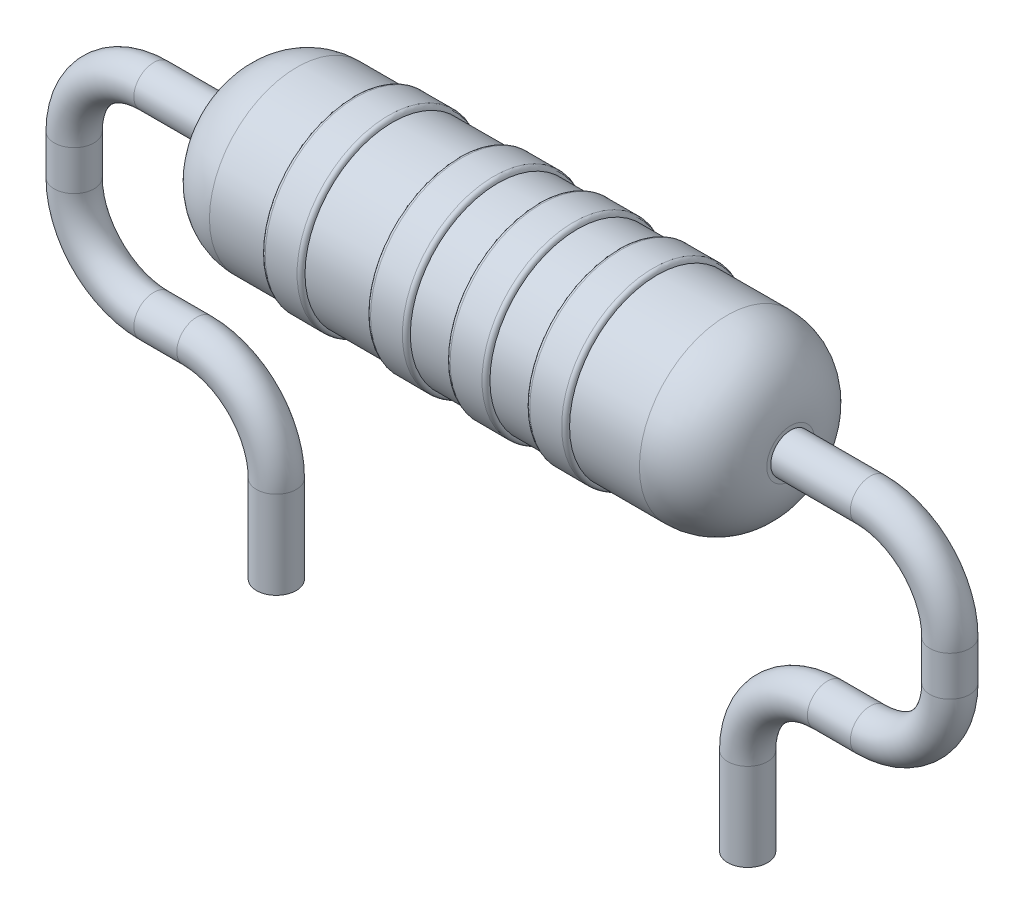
SolidWorks part; units mm, degrees
ref_plane "Face" through (0, 0, 0) normal (0, 0, 1) x (1, 0, 0)
ref_plane "Dessus" through (0, 0, 0) normal (0, 1, 0) x (1, 0, 0)
ref_plane "Droite" through (0, 0, 0) normal (1, 0, 0) x (0, 0, -1)
sketch "Esquisse1" plane through (0, 0, 0) normal (0, 0, 1) x (1, 0, 0)
  line L0 (-54.2687, 0) -> (62.1733, 0) construction
  line L1 (-48.4922, 1.1) -> (45.7559, 1.1) construction
  line L2 (-3.5, -1.6411) -> (-3.5, 4.3175) construction
  line L3 (0, -1.0268) -> (0, 4.1947) construction
  line L4 (3.5, 3.6009) -> (3.5, -1.9687) construction
  line L5 (-3.5, 0) -> (-3.5, 0.3)
  line L6 (-2.7, 1.1) -> (2.7, 1.1)
  line L7 (3.5, 0.3) -> (3.5, 0)
  line L8 (3.5, 0) -> (-3.5, 0)
  arc A0 (-2.7, 1.1) -> (-3.5, 0.3) centre (-2.7, 0.3) ccw
  arc A1 (3.5, 0.3) -> (2.7, 1.1) centre (2.7, 0.3) ccw
revolve "Base-Révolution" add sketch "Esquisse1" angle 360 about L0
sketch "Esquisse2" plane through (0, 0, 0) normal (0, 0, 1) x (1, 0, 0)
  line L0 (-3.3896, 1.15) -> (3.161, 1.15) construction
  line L1 (-2, 1.3889) -> (-2, -0.1179) construction
  line L2 (-1.5, 1.4925) -> (-1.5, -0.2136) construction
  line L3 (4.3262, 0) -> (-3.8651, 0) construction
  line L4 (1.323, 0) -> (1.823, 0)
  line L5 (0.323, 0) -> (0.823, 0)
  line L6 (-0.677, 1.15) -> (-0.677, 0)
  line L7 (0.323, 1.15) -> (0.323, 0)
  line L8 (1.323, 1.15) -> (1.323, 0)
  line L9 (-0.177, 1.15) -> (-0.177, 0)
  line L10 (0.823, 1.15) -> (0.823, 0)
  line L11 (1.823, 1.15) -> (1.823, 0)
  line L12 (-0.677, 0) -> (-0.177, 0)
  line L13 (-0.677, 1.15) -> (-0.177, 1.15)
  line L14 (0.323, 1.15) -> (0.823, 1.15)
  line L15 (1.323, 1.15) -> (1.823, 1.15)
  line L16 (-2, 1.15) -> (-1.5, 1.15)
  line L17 (-1.5, 1.15) -> (-1.5, 0)
  line L18 (-1.5, 0) -> (-2, 0)
  line L19 (-2, 0) -> (-2, 1.15)
revolve "Boss.-Révol.1" add sketch "Esquisse2" angle 360 about L3
fillet "Congé1" radius 0.05 8 edges at (-0.677, 0, -1.15) (-0.177, 0, -1.15) (0.323, 0, -1.15) (0.823, 0, -1.15) (1.323, 0, -1.15) (1.823, 0, -1.15) (-1.5, 0, -1.15) (-2, 0, -1.15)
sketch "Esquisse3" plane through (-3.5, 0, 0) normal (-1, 0, 0) x (0, 0, 1)
  circle A0 centre (0, 0) radius 0.25
sketch "Esquisse4" plane through (0, 0, 0) normal (0, 0, 1) x (1, 0, 0)
  line L0 (-3.1075, 0) -> (-5.8186, 0) construction
  line L1 (0, -2.524) -> (0, 3.2043) construction
  line L2 (-6.9487, -4.6) -> (5.5207, -4.6) construction
  line L3 (-5.5, 1.6795) -> (-5.5, -3.4934) construction
  line L4 (-3.5, 0) -> (-4.5, 0)
  line L5 (-5.5, -1) -> (-5.5, -1.5)
  line L6 (-2.96, -5.5395) -> (-2.96, -1.8755) construction
  line L7 (-6.9487, -2.5) -> (5.5207, -2.5) construction
  line L8 (-4.5, -2.5) -> (-3.96, -2.5)
  line L9 (-2.96, -3.5) -> (-2.96, -4.6)
  arc A0 (-4.5, 0) -> (-5.5, -1) centre (-4.5, -1) ccw
  arc A1 (-5.5, -1.5) -> (-4.5, -2.5) centre (-4.5, -1.5) ccw
  arc A2 (-3.96, -2.5) -> (-2.96, -3.5) centre (-3.96, -3.5) cw
  dimension "D3" = 1
  dimension "D6" = 1
  dimension "D1" = 2.5
  dimension "D2" = 5.5
  dimension "D4" = 2.96
  dimension "D5" = 2.1
sweep "Balayage1" add profiles "Esquisse3" path "Esquisse4"
ref_plane "Plan1" through (0, 0, 0) normal (1, 0, 0) x (0, 0, -1)
mirror "Symétrie1" about plane through (0, 0, 0) normal (1, 0, 0) of "Balayage1"
